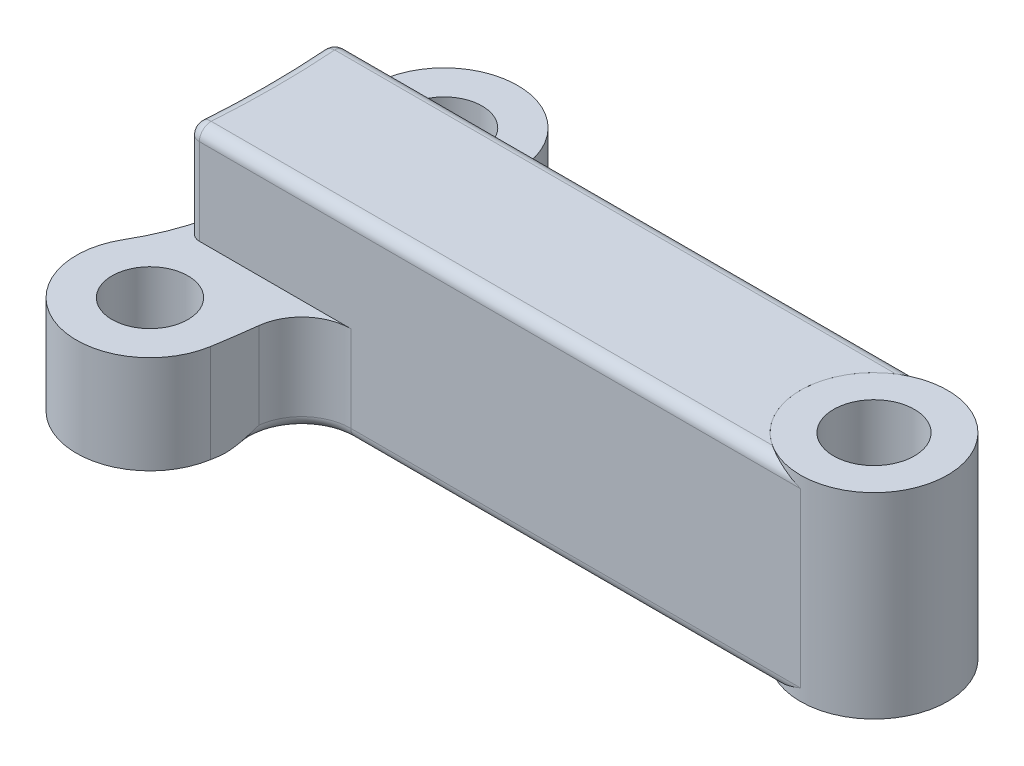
SolidWorks part; units mm, degrees
ref_plane "Front Plane" through (0, 0, 0) normal (0, 0, 1) x (1, 0, 0)
ref_plane "Top Plane" through (0, 0, 0) normal (0, 1, 0) x (1, 0, 0)
ref_plane "Right Plane" through (0, 0, 0) normal (1, 0, 0) x (0, 0, -1)
sketch "Sketch1" plane through (0, 0, 0) normal (0, 1, 0) x (1, 0, 0)
  line L0 (0, 0) -> (-41.8136, 0) construction
  line L1 (-34.7236, -4.7625) -> (5.0279, -4.7625)
  line L3 (-34.7236, 4.7625) -> (5.0279, 4.7625)
  arc A0 (-34.7236, -4.7625) -> (-34.7236, 4.7625) centre (-90.2983, 0) ccw
  circle A1 centre (5.0279, 0) radius 2.6162
  arc A3 (5.0279, -4.7625) -> (5.0279, 4.7625) centre (5.0279, 0) ccw
  circle A6 centre (-90.2983, 0) radius 55.7784 construction
  point P0 (0, 0)
  dimension "D2" = 5.2324
  dimension "D1" = 9.525
extrude "Boss-Extrude1" add sketch "Sketch1" along normal blind 12.7
sketch "Sketch2" plane through (0, 0, 0) normal (0, 1, 0) x (1, 0, 0)
  line L3 (0, 0) -> (-30.48, 0) construction
  line L5 (-30.48, 0) -> (-90.2983, 0) construction
  arc A0 (-27.6388, 10.2973) -> (-36.4493, 7.1207) centre (-32.3383, 9.525) ccw
  circle A2 centre (-32.3383, 9.525) radius 1.7272 construction
  arc A3 (-34.7236, -4.7625) -> (-34.7236, 4.7625) centre (-90.2983, 0) ccw construction
  arc A4 (-27.6388, -10.2973) -> (-27.6388, 10.2973) centre (-90.2983, 0) ccw
  circle A6 centre (-90.2983, 0) radius 63.5 construction
  arc A11 (-27.6388, -10.2973) -> (-36.4493, -7.1207) centre (-32.3383, -9.525) cw
  arc A12 (-36.4493, 7.1207) -> (-36.4493, -7.1207) centre (-48.6246, 0) cw
  dimension "D1" = 19.05
extrude "Boss-Extrude2" add sketch "Sketch2" along normal blind 6.35
hole_wizard "#10 (0.1935) Diameter Hole1" positions "Sketch4" profile "Sketch3" hole size "#10" standard "ANSI Inch"
sketch "Sketch4" plane through (0, 6.35, 0) normal (0, 1, 0) x (1, 0, 0)
  circle A0 centre (-32.3383, 9.525) radius 1.7272 construction
  circle A1 centre (-32.3383, -9.525) radius 1.7272 construction
  point P0 (-32.3383, -9.525)
  point P2 (-32.3383, 9.525)
sketch "Sketch3" plane through (-32.3383, 6.35, 9.525) normal (1, 0, 0) x (0, 0, 1)
  line L0 (0, 0) -> (0, 6.35)
  line L1 (0, 6.35) -> (2.4574, 6.35)
  line L2 (2.4574, 6.35) -> (2.4574, 0)
  line L5 (2.4574, 0) -> (0, 0)
  line L11 (0, -6.35) -> (0, 107.95) construction
  dimension "Thru Hole Dia." = 4.9149
  dimension "Thru Hole Depth" = 6.35
sketch "Sketch10" plane through (0, 12.7, 0) normal (0, 1, 0) x (1, 0, 0)
  circle A1 centre (5.0279, 0) radius 4.7625
  arc A2 (5.0279, -4.7625) -> (5.0279, 4.7625) centre (5.0279, 0) ccw construction
split "Split2" trim tools "Sketch10" bodies to split 103 resulting bodies 109 110
fillet "Fillet6" radius 3.175 2 edges at (-26.9772, 3.175, -4.7625) (-26.9772, 3.175, 4.7625)
fillet "Fillet7" radius 0.762 9 edges at (-34.5199, 12.7, 0) (-14.8479, 12.7, 4.7625) (-9.5348, 0, -4.7625) (-14.8479, 12.7, -4.7625) (-34.7236, 9.525, 4.7625) (-34.7236, 9.525, -4.7625) (-9.5348, 0, 4.7625) (-26.2047, 0, -5.5626) (-26.2047, 0, 5.5626)
